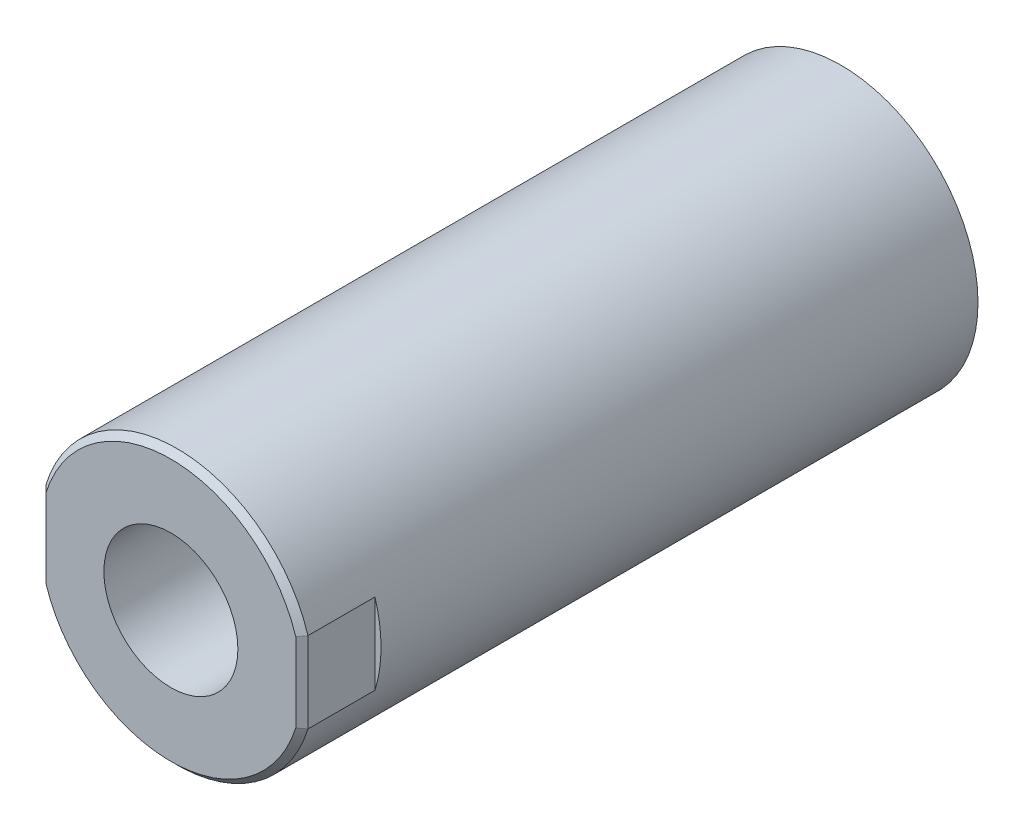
SolidWorks part; units mm, degrees
ref_plane "Front Plane" through (0, 0, 0) normal (0, 0, 1) x (1, 0, 0)
ref_plane "Top Plane" through (0, 0, 0) normal (0, 1, 0) x (1, 0, 0)
ref_plane "Right Plane" through (0, 0, 0) normal (1, 0, 0) x (0, 0, -1)
sketch "Sketch1" plane through (0, 0, 0) normal (0, 0, 1) x (1, 0, 0)
  circle A0 centre (0, 0) radius 22.5
  dimension "D1" = 45
extrude "S" add sketch "Sketch1" against normal blind 110
sketch "Sketch2" plane through (0, 0, 0) normal (0, 0, 1) x (1, 0, 0)
  circle A0 centre (0, 0) radius 22.5
  circle A1 centre (0, 0) radius 22.5 construction
  dimension "D1" = 45
extrude "L2" add sketch "Sketch2" along normal blind 15
hole_wizard "( T1xL4 ) M16x1.25 Tapped Hole1 " positions "3DSketch1" profile "Sketch5" tap size "M24x2.0" standard "Ansi Metric"
sketch3d "3DSketch1"
  circle A0 centre (0, 0, 15) radius 22.5 construction
  point P0 (0, 0, 15)
  point P5 (0, 0, 37.5)
sketch "Sketch5" plane through (0, 0, 15) normal (1, 0, 0) x (0, -1, 0)
  line L0 (0, 0) -> (0, 60.6095)
  line L1 (0, 60.6095) -> (11, 54)
  line L2 (11, 54) -> (11, 0)
  line L5 (11, 0) -> (0, 0)
  line L10 (0, 60.6095) -> (-11, 54) construction
  line L11 (0, -6.35) -> (0, 107.95) construction
  dimension "Tap Drill Dia." = 22
  dimension "Tap Drill Depth" = 54
  dimension "Drill Angle" = 118
chamfer "Chamfer2" distance 0.5 angle 45 1 edges at (22.5, 0, 15)
sketch "Sketch6" plane through (0, 0, 0) normal (0, 0, 1) x (1, 0, 0)
  circle A0 centre (0, 0) radius 22
  circle A1 centre (0, 0) radius 22.5
  circle A2 centre (0, 0) radius 22.5 construction
  circle A4 centre (0, 0) radius 22.5 construction
  dimension "D1" = 45
  dimension "D2" = 44
  dimension "D3" = 45
extrude "U/C" cut sketch "Sketch6" along normal blind 2
sketch "Sketch7" plane through (0, 0, 0) normal (0, 1, 0) x (1, 0, 0)
  line L1 (21.5, 0) -> (24, 0)
  line L2 (21.5, 0) -> (21.5, 12)
  line L3 (21.5, 12) -> (24, 12)
  line L4 (24, 0) -> (24, 12)
  line L5 (-24, 0) -> (-21.5, 0)
  line L6 (-24, 0) -> (-24, 12)
  line L7 (-24, 12) -> (-21.5, 12)
  line L8 (-21.5, 0) -> (-21.5, 12)
  line L12 (0, -2) -> (0, -14.5) construction
  line L13 (-22.5, 110) -> (22.5, 110) construction
  line L14 (0, 0) -> (0, -15) construction
  line L15 (0, 39) -> (0, -15) construction
  line L16 (-22, -15) -> (22, -15) construction
  dimension "D1" = 12
  dimension "D2" = 43
  dimension "D3" = 21.5
  dimension "D4" = 48
  dimension "D5" = 24
  dimension "D6" = 45
  dimension "D7" = 15
extrude "A/F" cut sketch "Sketch7" against normal mid plane 21
sketch "Sketch8" plane through (0, 0, 0) normal (0, 1, 0) x (1, 0, 0)
  line L1 (-29.7949, 0) -> (32.1852, 0)
  line L2 (-29.7949, 0) -> (-29.7949, -18.4612)
  line L3 (-29.7949, -18.4612) -> (32.1852, -18.4612)
  line L4 (32.1852, 0) -> (32.1852, -18.4612)
extrude "Cut-Extrude1" cut sketch "Sketch8" against normal mid plane 50
chamfer "Chamfer3" distance 1 angle 45 4 edges at (-21.5, 0, 0) (0, 22.5, 0) (0, -22.5, 0) (21.5, 0, 0)
equation "\"D2@Sketch6\" =\"D3@Sketch6\" - 1"
equation "\"D1@Sketch6\" = \"D3@Sketch6\""
equation "\"D2@Sketch7\" = \"D6@Sketch7\" - 2"
equation "\"D3@Sketch7\" = \"D2@Sketch7\" / 2"
equation "\"D4@Sketch7\" = \"D2@Sketch7\"+5"
equation "\"D5@Sketch7\" = \"D4@Sketch7\"/2"
equation "\"D1@Sketch7\" = \"D7@Sketch7\"-3"
